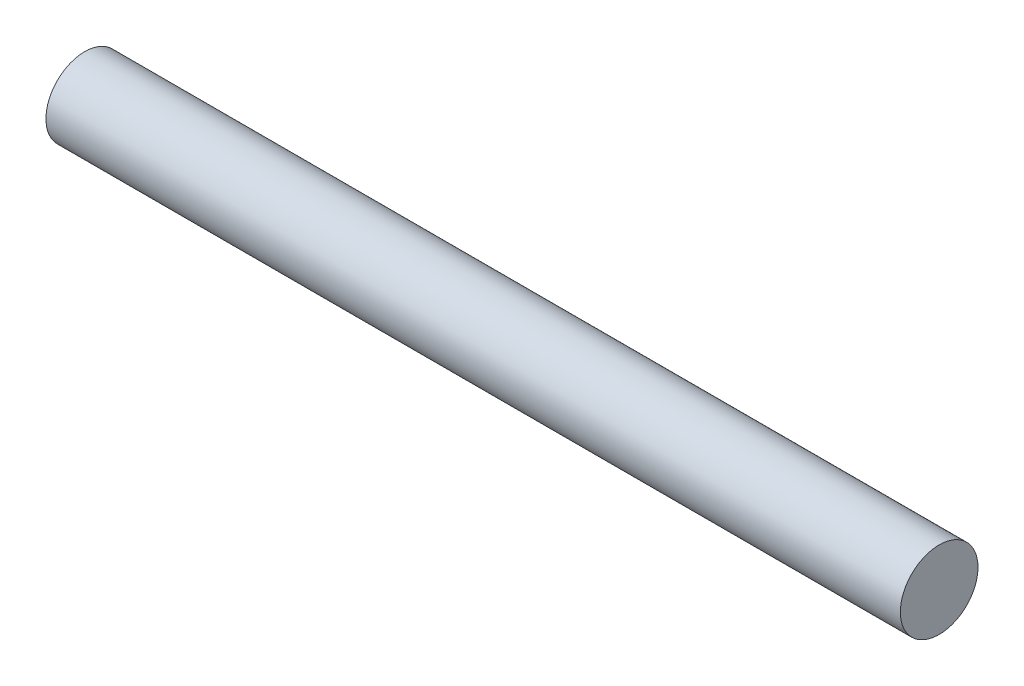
SolidWorks part; units mm, degrees
ref_plane "Alzado" through (0, 0, 0) normal (0, 0, 1) x (1, 0, 0)
ref_plane "Planta" through (0, 0, 0) normal (0, 1, 0) x (1, 0, 0)
ref_plane "Vista lateral" through (0, 0, 0) normal (1, 0, 0) x (0, 0, -1)
sketch "Croquis1" plane through (0, 0, 0) normal (1, 0, 0) x (0, 0, -1)
  circle A0 centre (0, 0) radius 10
  dimension "D1" = 20
extrude "Saliente-Extruir1" add sketch "Croquis1" along normal blind 220 contours A0
